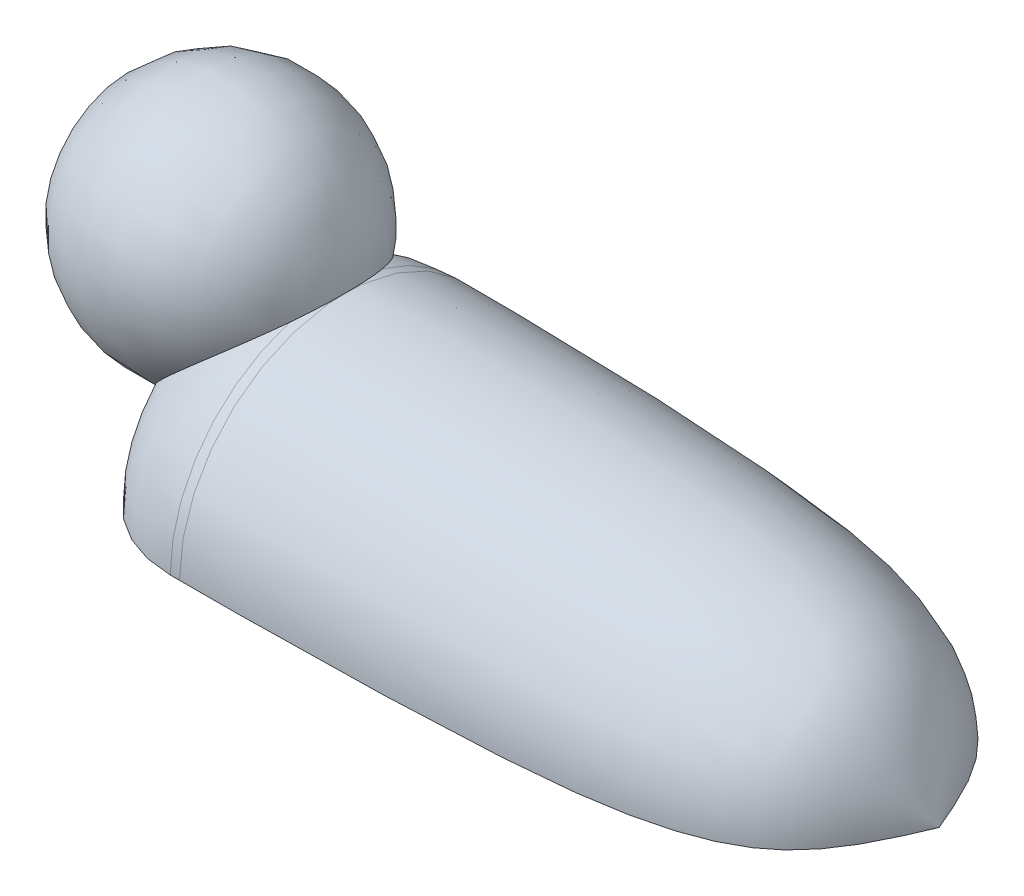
SolidWorks part; units mm, degrees
ref_plane "Plan de face" through (0, 0, 0) normal (0, 0, 1) x (1, 0, 0)
ref_plane "Plan de dessus" through (0, 0, 0) normal (0, 1, 0) x (1, 0, 0)
ref_plane "Plan de droite" through (0, 0, 0) normal (1, 0, 0) x (0, 0, -1)
sketch "Esquisse1" plane through (0, 0, 0) normal (0, 0, 1) x (1, 0, 0)
  line L0 (-27, 0) -> (27, 0)
  arc A0 (27, 0) -> (-27, 0) centre (0, 0) ccw
  dimension "D1" = 54
revolve "Révolution1" add sketch "Esquisse1" angle 360 about L0
sketch "Esquisse2" plane through (0, 0, 0) normal (0, 0, 1) x (1, 0, 0)
  line L0 (0, 0) -> (86.8519, 0) construction
  line L1 (27, 97.302) -> (27, -33.2081) construction
  line L2 (156, -36) -> (0, -36)
  line L3 (0, -36) -> (0, 0)
  line L4 (27, 0) -> (0, 0)
  circle A0 centre (0, 0) radius 27 construction
  spline_without_curve S0
  dimension "D1" = 156
  dimension "D2" = 36
revolve "Révolution2" add sketch "Esquisse2" angle 180 mid plane about L2
fillet "Congé1" radius 25 2 edges at (0, -21.9477, -33.1441) (0, -21.9477, 33.1441)
